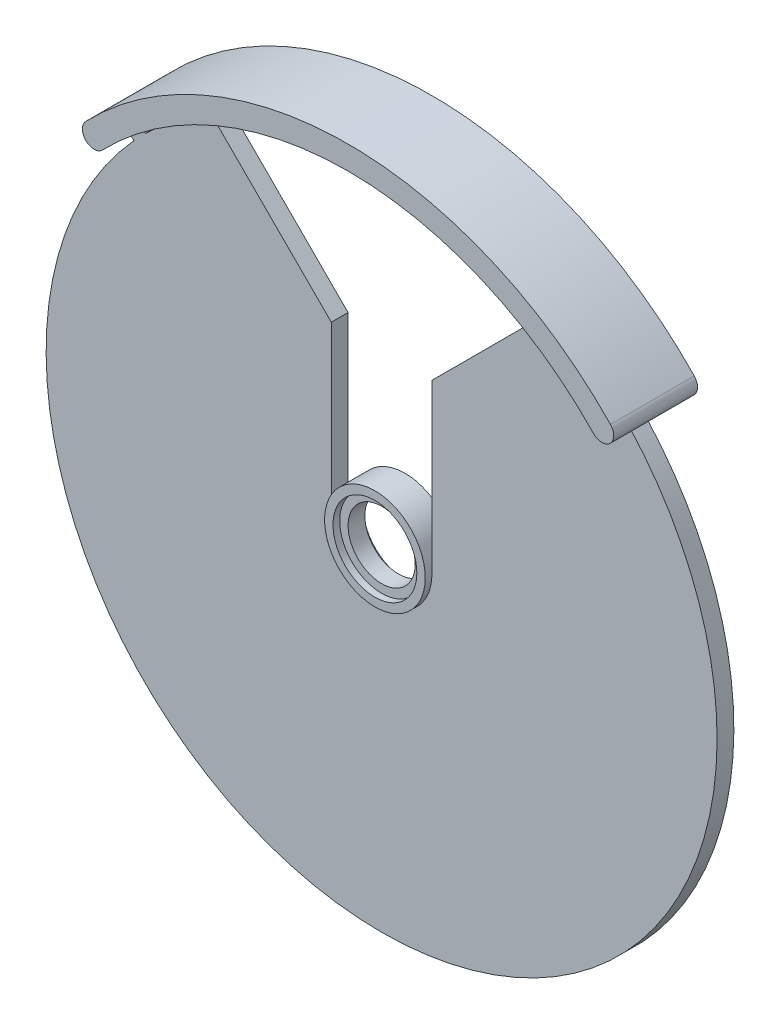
SolidWorks part; units mm, degrees
ref_plane "Front Plane" through (0, 0, 0) normal (0, 0, 1) x (1, 0, 0)
ref_plane "Top Plane" through (0, 0, 0) normal (0, 1, 0) x (1, 0, 0)
ref_plane "Right Plane" through (0, 0, 0) normal (1, 0, 0) x (0, 0, -1)
sketch "Sketch1" plane through (0, 0, 0) normal (0, 0, 1) x (1, 0, 0)
  circle A0 centre (0, 0) radius 2.54
  circle A1 centre (0, 0) radius 25.4
extrude "Boss-Extrude1" add sketch "Sketch1" along normal blind 1.27
sketch "Sketch2" plane through (0, 0, 1.27) normal (0, 0, 1) x (1, 0, 0)
  line L0 (-17.9605, 17.9605) -> (-19.7566, 19.7566) construction
  line L1 (-20.1158, 19.3974) -> (-19.3974, 20.1158)
  line L2 (-20.1158, 19.3974) -> (-18.3161, 17.5977)
  line L4 (-19.3974, 20.1158) -> (-17.631, 18.284)
  circle A0 centre (0, 0) radius 25.4 construction
  arc A1 (-17.631, 18.284) -> (-18.3161, 17.5977) centre (0, 0) ccw
  dimension "D1" = 2.54
  dimension "D2" = 0.508
extrude "Boss-Extrude2" add sketch "Sketch2" against normal blind 1.27
sketch "Sketch3" plane through (0, 0, 1.27) normal (0, 0, 1) x (1, 0, 0)
  line L1 (-20.1158, 19.3974) -> (-20.8342, 18.6789)
  line L2 (-20.8342, 18.6789) -> (-19.0058, 16.8505)
  line L3 (-20.1158, 19.3974) -> (-18.3161, 17.5977) construction
  line L4 (-20.1158, 19.3974) -> (-18.3161, 17.5977)
  arc A0 (-18.3161, 17.5977) -> (-17.631, 18.284) centre (0, 0) ccw construction
  arc A1 (-18.3161, 17.5977) -> (-19.0058, 16.8505) centre (0, 0) ccw
  dimension "D1" = 1.016
extrude "Boss-Extrude3" add sketch "Sketch3" against normal blind 1.27
sketch "Sketch4" plane through (0, 0, 0) normal (0, 0, -1) x (-1, 0, 0)
  line L0 (18.5142, 19.1999) -> (19.9347, 17.7794) construction
  circle A2 centre (19.2244, 18.4897) radius 0.889
extrude "Boss-Extrude6" add sketch "Sketch4" along normal blind 2.54
sketch "Sketch5" plane through (0, 0, 0) normal (0, 0, -1) x (-1, 0, 0)
  line L0 (17.631, 18.284) -> (19.3974, 20.1158) construction
  line L1 (19.3974, 20.1158) -> (20.8342, 18.6789) construction
  line L2 (20.8342, 18.6789) -> (19.0058, 16.8505) construction
  line L3 (17.631, 18.284) -> (19.3974, 20.1158)
  line L4 (19.3974, 20.1158) -> (20.8342, 18.6789)
  line L5 (20.8342, 18.6789) -> (19.0058, 16.8505)
  line L6 (18.3354, 18.4897) -> (17.8832, 18.0375)
  line L7 (19.2244, 17.6007) -> (18.754, 17.1303)
  circle A0 centre (19.2244, 18.4897) radius 0.889 construction
  circle A1 centre (19.2244, 18.4897) radius 0.889
  arc A2 (19.0058, 16.8505) -> (17.631, 18.284) centre (0, 0) ccw
extrude "Cut-Extrude1" cut sketch "Sketch5" against normal blind 2.54 contours A2 L6 L7 M3 M4 M5 M1
sketch "Sketch6" plane through (0, 0, 1.27) normal (0, 0, 1) x (1, 0, 0)
  line L0 (0, 25.4) -> (0, -25.4) construction
  arc A0 (-18.754, 17.1303) -> (-17.8832, 18.0375) centre (0, 0) ccw construction
ref_plane "Plane1" through (0, 0, 0) normal (-1, 0, 0) x (0, -1, 0)
sketch "Sketch7" plane through (0, 0, 1.27) normal (0, 0, 1) x (1, 0, 0)
  line L0 (0, 25.4) -> (0, -25.4) construction
  line L1 (0, 25.4) -> (0, -25.4)
  line L6 (17.8832, 18.0375) -> (18.3354, 18.4897)
  line L7 (19.2244, 17.6007) -> (18.754, 17.1303)
  arc A1 (18.3354, 18.4897) -> (19.2244, 17.6007) centre (19.2244, 18.4897) cw
  arc A4 (17.8832, 18.0375) -> (18.754, 17.1303) centre (0, 0) cw
extrude "Boss-Extrude7" add sketch "Sketch7" against normal blind 1.27 contours A1 L6 L7 M8
sketch "Sketch8" plane through (0, 0, 0) normal (0, 0, -1) x (-1, 0, 0)
  arc A0 (-18.3354, 18.4897) -> (-19.2244, 17.6007) centre (-19.2244, 18.4897) ccw construction
  circle A2 centre (-19.2244, 18.4897) radius 0.889
extrude "Boss-Extrude8" add sketch "Sketch8" along normal up to surface (2.54 mm away)
sketch "Sketch9" plane through (0, 0, 1.27) normal (0, 0, 1) x (1, 0, 0)
  circle A0 centre (-19.2244, 18.4897) radius 0.889
  circle A1 centre (19.2244, 18.4897) radius 0.889
extrude "Boss-Extrude9" add sketch "Sketch9" along normal blind 2.54
sketch "Sketch10" plane through (0, 0, 1.27) normal (0, 0, 1) x (1, 0, 0)
  line L0 (0, 2.54) -> (0, 25.4) construction
  line L1 (3.81, 0) -> (3.81, 12.7)
  line L2 (-3.81, 0) -> (-3.81, 12.7)
  line L3 (-3.81, 12.7) -> (-12.9568, 21.8468)
  line L4 (3.81, 12.7) -> (12.9568, 21.8468)
  circle A0 centre (0, 0) radius 2.54 construction
  arc A1 (17.8832, 18.0375) -> (-17.8832, 18.0375) centre (0, 0) ccw construction
  circle A2 centre (0, 0) radius 3.81
  arc A3 (12.9568, 21.8468) -> (-12.9568, 21.8468) centre (0, 0) ccw
  dimension "D1" = 12.7
extrude "Cut-Extrude2" cut sketch "Sketch10" against normal blind 2.54 contours A2 L0 A3 L3 L2 | L0 A2 L1 L4 M7
sketch "Sketch11" plane through (0, 0, 1.27) normal (0, 0, 1) x (1, 0, 0)
  line L0 (0, 0) -> (8.9803, 8.9803) construction
  line L1 (0, 0) -> (0, 14.2414) construction
  line L2 (0, 0) -> (-8.9803, 8.9803) construction
  circle A0 centre (-8.9803, 8.9803) radius 1.27
  circle A1 centre (8.9803, 8.9803) radius 1.27
  dimension "D1" = 12.7
ref_plane "Plane3" through (0, 0, 0.635) normal (0, 0, 1) x (1, 0, 0)
sketch "Sketch15" plane through (0, 0, 1.27) normal (0, 0, 1) x (1, 0, 0)
  circle A0 centre (0, 0) radius 3.175
  circle A1 centre (0, 0) radius 3.81
extrude "Boss-Extrude12" add sketch "Sketch15" along normal blind 0.508
mirror "Mirror5" about plane through (0, 0, 0.635) normal (0, 0, 1) of "Boss-Extrude12"
sketch "Sketch16" plane through (0, 0, 3.81) normal (0, 0, 1) x (1, 0, 0)
  arc A0 (18.5837, 17.8734) -> (-18.5837, 17.8734) centre (0, 0) ccw
  arc A1 (19.8652, 19.1059) -> (-19.8652, 19.1059) centre (0, 0) ccw
  circle A2 centre (-19.2244, 18.4897) radius 0.889 construction
  circle A3 centre (19.2244, 18.4897) radius 0.889 construction
  circle A4 centre (-19.2244, 18.4897) radius 0.889
  circle A5 centre (19.2244, 18.4897) radius 0.889
extrude "Boss-Extrude14" add sketch "Sketch16" against normal up to surface (6.35 mm away) contours M1 | A5 A1 A0 M1 | A5 A4
